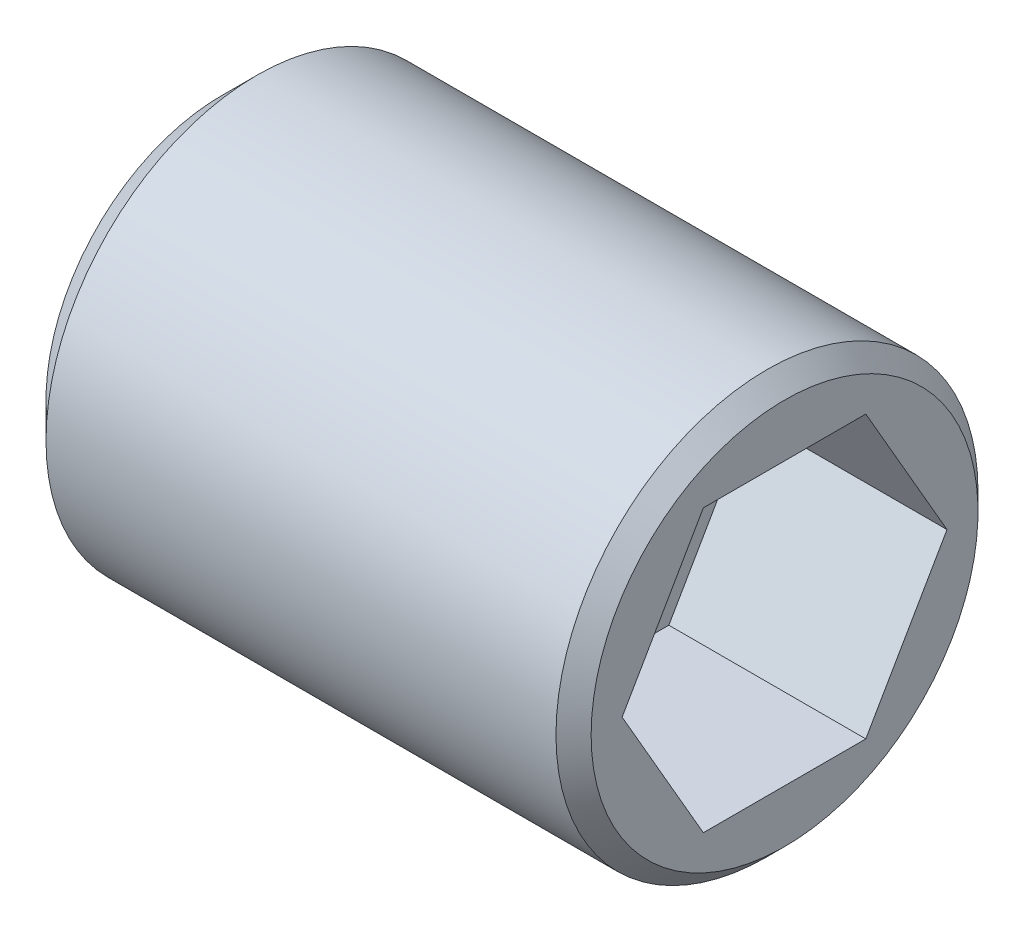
SolidWorks part; units mm, degrees
ref_plane "Plan1" through (0, 0, 0) normal (0, 0, 1) x (1, 0, 0)
ref_plane "Plan2" through (0, 0, 0) normal (0, 1, 0) x (1, 0, 0)
ref_plane "Plan3" through (0, 0, 0) normal (1, 0, 0) x (0, 0, -1)
sketch "Esquisse1" plane through (0, 0, 0) normal (0, 0, 1) x (1, 0, 0)
  line L0 (-25.8285, 0) -> (47.3208, 0) construction
  line L1 (0, 0) -> (0, 3)
  line L2 (0, 3) -> (8, 3)
  line L4 (8, 3) -> (8, 0)
  line L5 (8, 0) -> (0, 0)
  dimension "D1" = 6
  dimension "D2" = 8
revolve "Base-Révolution" add sketch "Esquisse1" angle 360 about L0
chamfer "Chanfrein2" distance 0.5 angle 45 1 edges at (0, 0, 3)
sketch "Esquisse2" plane through (8, 0, 0) normal (1, 0, 0) x (0, 0, -1)
  line L1 (2.3094, 0) -> (1.1547, 2)
  line L2 (1.1547, 2) -> (-1.1547, 2)
  line L3 (-1.1547, 2) -> (-2.3094, 0)
  line L4 (-2.3094, 0) -> (-1.1547, -2)
  line L5 (-1.1547, -2) -> (1.1547, -2)
  line L6 (1.1547, -2) -> (2.3094, 0)
  circle A0 centre (0, 0) radius 2 construction
  dimension "D1" = 4
extrude "Empreinte pour clé" cut sketch "Esquisse2" against normal blind 2.8
chamfer "Chanfrein3" distance 0.25 angle 45 1 edges at (8, 0, 3)
sketch "Esq_WRNL_Compact001" plane through (0, 0, 0) normal (0, 0, 1) x (1, 0, 0)
  line L0 (-1, -4) -> (-1, 4)
  line L1 (9, -4) -> (9, 4)
  line L2 (-1, -4) -> (9, -4)
  line L3 (-1, 4) -> (9, 4)
